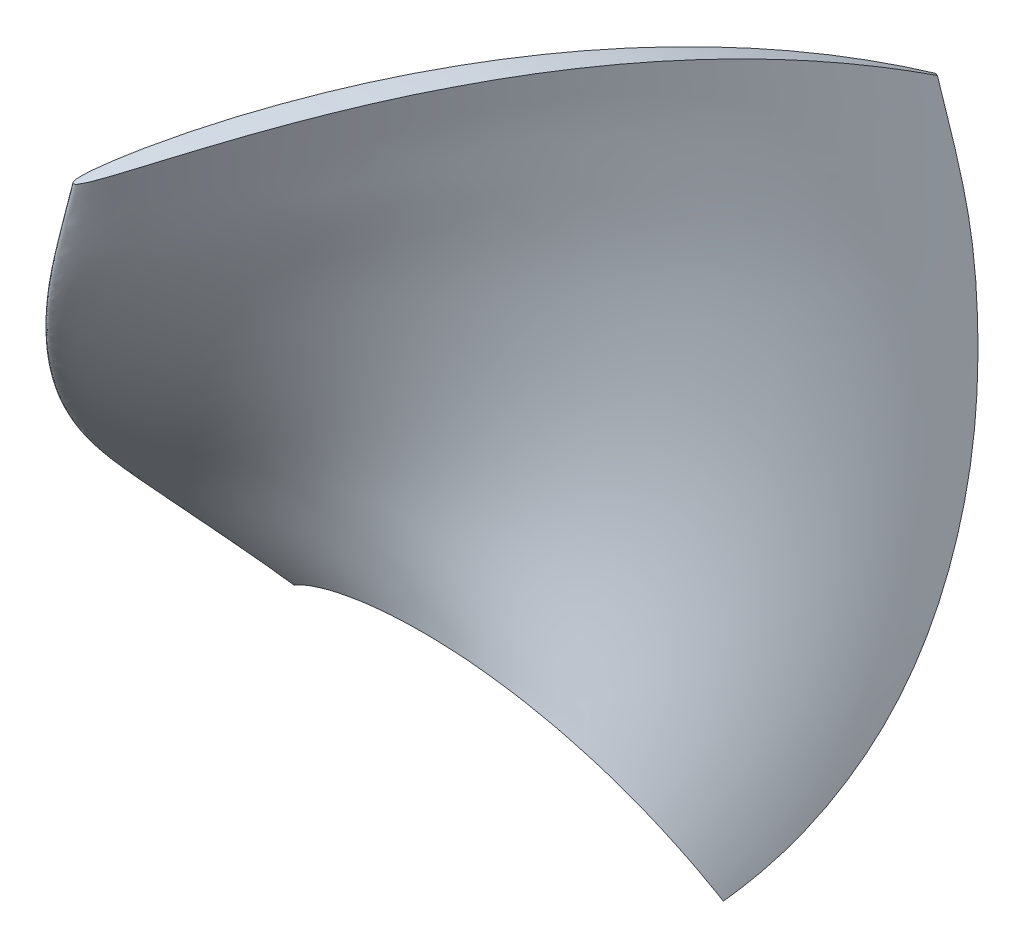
SolidWorks part; units mm, degrees
other "<Kaplanfluegel>-<Oberflächenausfüllung5>"
ref_plane "Ebene vorne" through (0, 0, 0) normal (0, 0, 1) x (1, 0, 0)
ref_plane "Ebene oben" through (0, 0, 0) normal (0, 1, 0) x (1, 0, 0)
ref_plane "Ebene rechts" through (0, 0, 0) normal (1, 0, 0) x (0, 0, -1)
mirrored part "Kaplanfluegel_Gespiegelt"
equation "\"Gesamtgewicht\"=\"SW-Masse\"/1000"
